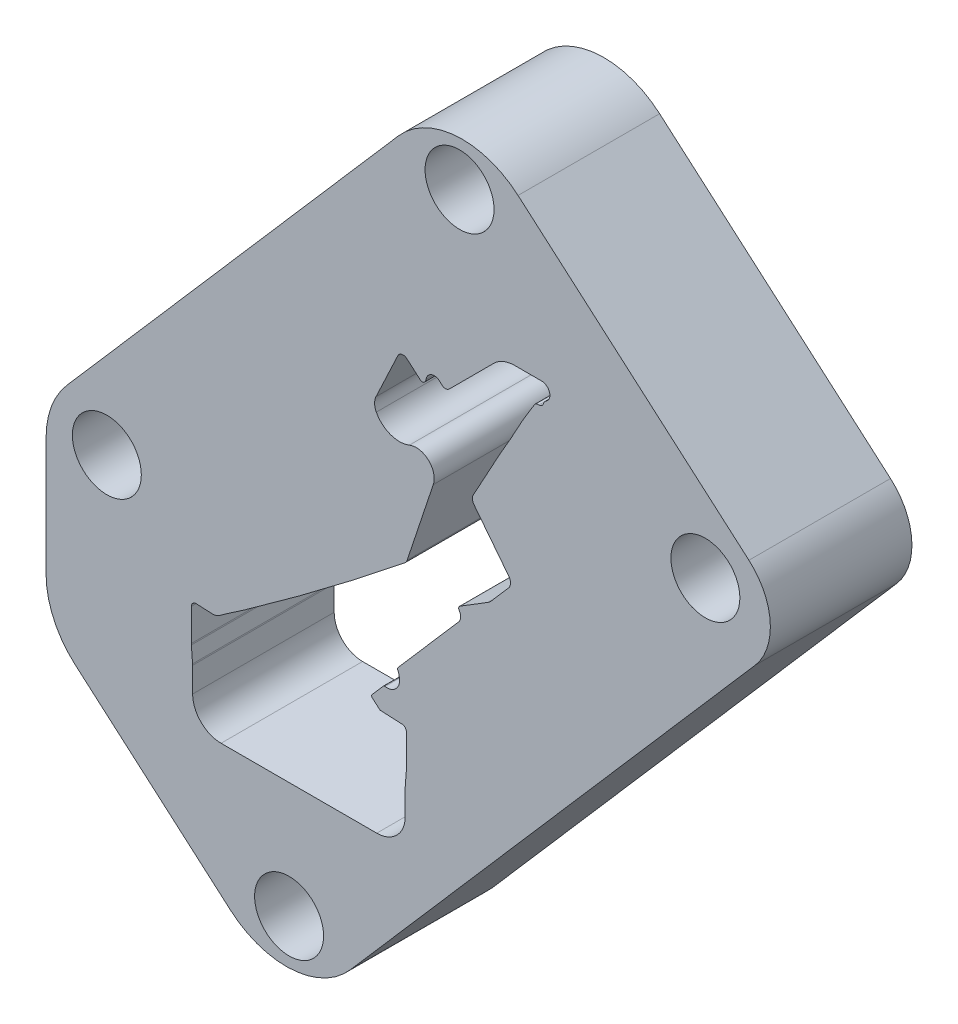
SolidWorks part; units mm, degrees
ref_plane "Front" through (0, 0, 0) normal (0, 0, 1) x (1, 0, 0)
ref_plane "Top" through (0, 0, 0) normal (0, 1, 0) x (1, 0, 0)
ref_plane "Right" through (0, 0, 0) normal (1, 0, 0) x (0, 0, -1)
ref_plane "Plane1"
sketch "Sketch1" plane through (0, 0, 0) normal (0, 0, 1) x (1, 0, 0)
  line L0 (-57.15, -180.975) -> (-450.85, -180.975) construction
  line L1 (-277.3377, -5.7393) -> (-329.1177, 39.2279)
  line L2 (-275.9499, -25.4471) -> (-366.7171, -129.9659)
  line L3 (-393.5913, -131.8583) -> (-428.4159, -101.6157)
  line L4 (-355.9919, 37.3355) -> (-430.3083, -48.2402)
  line L5 (-450.85, 149.225) -> (-450.85, -180.975) construction
  line L10 (-379.857, -85.471) -> (-379.857, 85.471) construction
  line L12 (-300.355, 0) -> (-340.106, 0) construction
  line L13 (-434.975, -87.2323) -> (-434.975, -60.7311)
  arc A0 (-329.1177, 39.2279) -> (-355.9919, 37.3355) centre (-341.6086, 24.8446) ccw
  arc A1 (-366.7171, -129.9659) -> (-393.5913, -131.8583) centre (-381.1005, -117.475) cw
  arc A2 (-428.4159, -101.6157) -> (-434.975, -87.2323) centre (-415.925, -87.2323) cw
  arc A3 (-277.3377, -5.7393) -> (-275.9499, -25.4471) centre (-286.4977, -16.2871) cw
  arc A4 (-430.3083, -48.2402) -> (-434.975, -60.7311) centre (-415.925, -60.7311) ccw
  arc A5 (-360.807, -100.457) -> (-354.457, -94.107) centre (-360.807, -94.107) ccw construction
  point P11 (-343.501, 51.7188)
  point P14 (-299.257, -129.8359)
  point P17 (-438.813, -92.8979)
extrude "Boss-Extrude1" add sketch "Sketch1" against normal blind 31.75 flip side to cut
hole_wizard "Hole1" positions "Point_Sketch" profile "Profil_Sketch" counterbore size "1/4" standard "ANSI Inch"
sketch "Point_Sketch" plane through (-333.7905, -24.1266, 0) normal (0, 0, -1) x (1, 0, 0)
  point P0 (-8.4489, -57.9293)
  point P2 (46.6872, -10.0475)
  point P4 (-46.6791, 102.3065)
  point P6 (-87.5579, 33.1651)
sketch "Profil_Sketch" plane through (-342.2394, 33.8027, 0) normal (1, 0, 0) x (0, -1, 0)
  line L0 (0, 0) -> (0, 31.75)
  line L1 (0, 31.75) -> (5.1562, 31.75)
  line L3 (5.1562, 31.75) -> (5.1562, 17.526)
  line L4 (5.1562, 17.526) -> (7.7343, 17.526)
  line L5 (7.7343, 17.526) -> (7.7343, 0)
  line L7 (7.7343, 0) -> (0, 0)
  line L11 (0, -6.35) -> (0, 107.95) construction
  dimension "Diameter" = 10.3124
  dimension "Thru Hole Depth" = 31.75
  dimension "L1" = 17.526
other "usin_LS160_.375-16x1.75-SHCS<1>"
ref_plane "Plane2 QU250515L_Punch26[Mounted in the strip]-1"
ref_plane "Plane1 QU250515L_Punch26[Mounted in the strip]-1"
sketch "Sketch2 QU250515L_Punch26[Mounted in the strip]-1" plane through (0, 0, 0) normal (0, 0, 1) x (1, 0, 0)
  line L0 (-395.732, -100.457) -> (-360.807, -100.457)
  line L1 (-330.9926, -8.5838) -> (-328.8227, -4.6121)
  line L2 (-333.575, -13.0808) -> (-330.9926, -8.5838)
  line L3 (-339.4259, -23.7902) -> (-333.575, -13.0808)
  line L4 (-331.4508, -35.9487) -> (-339.2462, -25.9811)
  line L5 (-335.3571, -42.3275) -> (-331.5006, -37.8868)
  line L6 (-342.2674, -46.7609) -> (-336.0871, -42.9478)
  line L7 (-356.2916, -65.7245) -> (-342.683, -50.0542)
  line L8 (-356.0262, -67.9839) -> (-356.0832, -67.5125)
  line L9 (-362.0951, -73.879) -> (-359.5997, -71.0056)
  line L10 (-360.19, -76.5426) -> (-362.0194, -74.954)
  line L11 (-355.1831, -76.7786) -> (-360.19, -76.5426)
  line L12 (-354.457, -94.107) -> (-354.457, -77.5397)
  line L13 (-402.082, -77.2405) -> (-402.082, -94.107)
  line L14 (-397.7792, -76.6445) -> (-401.2841, -76.4793)
  line L15 (-390.1929, -72.1537) -> (-394.0689, -74.806)
  line L16 (-347.8332, -26.553) -> (-353.6879, -44.1622)
  line L17 (-355.8003, -5.5368) -> (-360.6884, -15.925)
  line L18 (-351.2631, -7.7925) -> (-354.2397, -5.2075)
  line L19 (-349.7815, -7.636) -> (-349.8298, -7.6916)
  line L20 (-346.4728, -6.3117) -> (-346.832, -5.9525)
  line L21 (-334.357, 3.6489) -> (-344.3176, -6.3117)
  line L22 (-323.8215, 5.5088) -> (-329.8669, 5.5088)
  line L23 (-323.8215, 5.5088) -> (-329.8669, 5.5088)
  line L24 (-334.357, 3.6489) -> (-344.3176, -6.3117)
  line L25 (-346.4728, -6.3117) -> (-346.832, -5.9525)
  line L26 (-349.7815, -7.636) -> (-349.8298, -7.6916)
  line L27 (-351.2631, -7.7925) -> (-354.2397, -5.2075)
  line L28 (-355.8003, -5.5368) -> (-360.6884, -15.925)
  line L29 (-347.8332, -26.553) -> (-353.6879, -44.1622)
  line L30 (-390.1929, -72.1537) -> (-394.0689, -74.806)
  line L31 (-397.7792, -76.6445) -> (-401.2841, -76.4793)
  line L32 (-402.082, -77.2405) -> (-402.082, -94.107)
  line L33 (-354.457, -94.107) -> (-354.457, -77.5397)
  line L34 (-355.1831, -76.7786) -> (-360.19, -76.5426)
  line L35 (-360.19, -76.5426) -> (-362.0194, -74.954)
  line L36 (-362.0951, -73.879) -> (-359.5997, -71.0056)
  line L37 (-356.0262, -67.9839) -> (-356.0832, -67.5125)
  line L38 (-356.2916, -65.7245) -> (-342.683, -50.0542)
  line L39 (-342.2674, -46.7609) -> (-336.0871, -42.9478)
  line L40 (-335.3571, -42.3275) -> (-331.5006, -37.8868)
  line L41 (-331.4508, -35.9487) -> (-339.2462, -25.9811)
  line L42 (-339.4259, -23.7902) -> (-333.575, -13.0808)
  line L43 (-333.575, -13.0808) -> (-330.9926, -8.5838)
  line L44 (-330.9926, -8.5838) -> (-328.8227, -4.6121)
  line L45 (-395.732, -100.457) -> (-360.807, -100.457)
  arc A0 (-360.807, -100.457) -> (-354.457, -94.107) centre (-360.807, -94.107) ccw
  arc A1 (-402.082, -94.107) -> (-395.732, -100.457) centre (-395.732, -94.107) ccw
  arc A2 (-323.0273, 2.6841) -> (-323.6241, 2.0061) centre (-322.2331, 1.3833) ccw
  arc A3 (-323.6241, 2.0061) -> (-323.8295, 1.5414) centre (-274.8211, -19.8428) ccw
  arc A4 (-324.4132, 1.1898) -> (-323.8295, 1.5414) centre (-324.369, 1.7768) ccw
  arc A5 (-324.4132, 1.1898) -> (-325.3006, 0.9984) centre (-324.5334, -0.4056) ccw
  arc A6 (-325.3006, 0.9984) -> (-325.6667, 0.6547) centre (-324.8211, 0.1209) ccw
  arc A7 (-325.6667, 0.6547) -> (-327.9343, -3.0725) centre (-213.8052, -69.9538) ccw
  arc A8 (-327.9343, -3.0725) -> (-328.3877, -3.8375) centre (-295.3841, -22.8808) ccw
  arc A9 (-328.3877, -3.8375) -> (-328.8227, -4.6121) centre (-246.2982, -50.4461) ccw
  arc A10 (-339.4259, -23.7902) -> (-339.2462, -25.9811) centre (-337.6707, -24.7491) ccw
  arc A11 (-331.5006, -37.8868) -> (-331.4508, -35.9487) centre (-332.6513, -36.8875) ccw
  arc A12 (-336.0871, -42.9478) -> (-335.3571, -42.3275) centre (-337.7543, -40.2457) ccw
  arc A13 (-342.2674, -46.7609) -> (-342.5738, -48.1973) centre (-341.734, -47.6256) ccw
  arc A14 (-342.683, -50.0542) -> (-342.5738, -48.1973) centre (-343.8336, -49.0549) ccw
  arc A15 (-356.2916, -65.7245) -> (-356.3817, -66.5953) centre (-355.7162, -66.2241) ccw
  arc A16 (-356.0832, -67.5125) -> (-356.3817, -66.5953) centre (-358.5651, -67.813) ccw
  arc A17 (-358.9038, -70.7528) -> (-356.0262, -67.9839) centre (-358.5081, -68.2843) ccw
  arc A18 (-358.9038, -70.7528) -> (-359.5997, -71.0056) centre (-359.0244, -71.5052) ccw
  arc A19 (-362.0951, -73.879) -> (-362.0194, -74.954) centre (-361.5197, -74.3786) ccw
  arc A20 (-354.457, -77.5397) -> (-355.1831, -76.7786) centre (-355.219, -77.5397) ccw
  arc A21 (-401.2841, -76.4793) -> (-402.082, -77.2405) centre (-401.32, -77.2405) ccw
  arc A22 (-397.7792, -76.6445) -> (-395.8662, -76.0817) centre (-397.6357, -73.5999) ccw
  arc A23 (-394.0689, -74.806) -> (-395.8662, -76.0817) centre (-95.1891, -497.8086) ccw
  arc A24 (-390.1929, -72.1537) -> (-354.3303, -45.0881) centre (-793.7243, 499.8274) ccw
  arc A25 (-354.3303, -45.0881) -> (-353.6879, -44.1622) centre (-355.5857, -43.5312) ccw
  arc A26 (-347.8332, -26.553) -> (-353.6039, -21.1528) centre (-351.961, -25.1806) ccw
  arc A27 (-360.6258, -18.602) -> (-353.6039, -21.1528) centre (-355.7059, -15.999) ccw
  arc A28 (-360.6884, -15.925) -> (-360.6258, -18.602) centre (-357.9773, -17.2007) ccw
  arc A29 (-354.2397, -5.2075) -> (-355.8003, -5.5368) centre (-354.8954, -5.9625) ccw
  arc A30 (-351.2631, -7.7925) -> (-349.8298, -7.6916) centre (-350.5969, -7.0254) ccw
  arc A31 (-349.7815, -7.636) -> (-349.4209, -6.8334) centre (-350.9322, -6.6367) ccw
  arc A32 (-346.832, -5.9525) -> (-349.4209, -6.8334) centre (-347.9097, -7.0301) ccw
  arc A33 (-346.4728, -6.3117) -> (-344.3176, -6.3117) centre (-345.3952, -5.234) ccw
  arc A34 (-329.8669, 5.5088) -> (-334.357, 3.6489) centre (-329.8669, -0.8412) ccw
  arc A35 (-323.0273, 2.6841) -> (-323.8215, 5.5088) centre (-323.8215, 3.9848) ccw
  arc A36 (-323.0273, 2.6841) -> (-323.8215, 5.5088) centre (-323.8215, 3.9848) ccw
  arc A37 (-329.8669, 5.5088) -> (-334.357, 3.6489) centre (-329.8669, -0.8412) ccw
  arc A38 (-346.4728, -6.3117) -> (-344.3176, -6.3117) centre (-345.3952, -5.234) ccw
  arc A39 (-346.832, -5.9525) -> (-349.4209, -6.8334) centre (-347.9097, -7.0301) ccw
  arc A40 (-349.7815, -7.636) -> (-349.4209, -6.8334) centre (-350.9322, -6.6367) ccw
  arc A41 (-351.2631, -7.7925) -> (-349.8298, -7.6916) centre (-350.5969, -7.0254) ccw
  arc A42 (-354.2397, -5.2075) -> (-355.8003, -5.5368) centre (-354.8954, -5.9625) ccw
  arc A43 (-360.6884, -15.925) -> (-360.6258, -18.602) centre (-357.9773, -17.2007) ccw
  arc A44 (-360.6258, -18.602) -> (-353.6039, -21.1528) centre (-355.7059, -15.999) ccw
  arc A45 (-347.8332, -26.553) -> (-353.6039, -21.1528) centre (-351.961, -25.1806) ccw
  arc A46 (-354.3303, -45.0881) -> (-353.6879, -44.1622) centre (-355.5857, -43.5312) ccw
  arc A47 (-390.1929, -72.1537) -> (-354.3303, -45.0881) centre (-793.7243, 499.8274) ccw
  arc A48 (-394.0689, -74.806) -> (-395.8662, -76.0817) centre (-95.1891, -497.8086) ccw
  arc A49 (-397.7792, -76.6445) -> (-395.8662, -76.0817) centre (-397.6357, -73.5999) ccw
  arc A50 (-401.2841, -76.4793) -> (-402.082, -77.2405) centre (-401.32, -77.2405) ccw
  arc A51 (-354.457, -77.5397) -> (-355.1831, -76.7786) centre (-355.219, -77.5397) ccw
  arc A52 (-362.0951, -73.879) -> (-362.0194, -74.954) centre (-361.5197, -74.3786) ccw
  arc A53 (-358.9038, -70.7528) -> (-359.5997, -71.0056) centre (-359.0244, -71.5052) ccw
  arc A54 (-358.9038, -70.7528) -> (-356.0262, -67.9839) centre (-358.5081, -68.2843) ccw
  arc A55 (-356.0832, -67.5125) -> (-356.3817, -66.5953) centre (-358.5651, -67.813) ccw
  arc A56 (-356.2916, -65.7245) -> (-356.3817, -66.5953) centre (-355.7162, -66.2241) ccw
  arc A57 (-342.683, -50.0542) -> (-342.5738, -48.1973) centre (-343.8336, -49.0549) ccw
  arc A58 (-342.2674, -46.7609) -> (-342.5738, -48.1973) centre (-341.734, -47.6256) ccw
  arc A59 (-336.0871, -42.9478) -> (-335.3571, -42.3275) centre (-337.7543, -40.2457) ccw
  arc A60 (-331.5006, -37.8868) -> (-331.4508, -35.9487) centre (-332.6513, -36.8875) ccw
  arc A61 (-339.4259, -23.7902) -> (-339.2462, -25.9811) centre (-337.6707, -24.7491) ccw
  arc A62 (-328.3877, -3.8375) -> (-328.8227, -4.6121) centre (-246.2982, -50.4461) ccw
  arc A63 (-327.9343, -3.0725) -> (-328.3877, -3.8375) centre (-295.3841, -22.8808) ccw
  arc A64 (-325.6667, 0.6547) -> (-327.9343, -3.0725) centre (-213.8052, -69.9538) ccw
  arc A65 (-325.3006, 0.9984) -> (-325.6667, 0.6547) centre (-324.8211, 0.1209) ccw
  arc A66 (-324.4132, 1.1898) -> (-325.3006, 0.9984) centre (-324.5334, -0.4056) ccw
  arc A67 (-324.4132, 1.1898) -> (-323.8295, 1.5414) centre (-324.369, 1.7768) ccw
  arc A68 (-323.6241, 2.0061) -> (-323.8295, 1.5414) centre (-274.8211, -19.8428) ccw
  arc A69 (-323.0273, 2.6841) -> (-323.6241, 2.0061) centre (-322.2331, 1.3833) ccw
  arc A70 (-402.082, -94.107) -> (-395.732, -100.457) centre (-395.732, -94.107) ccw
  arc A71 (-360.807, -100.457) -> (-354.457, -94.107) centre (-360.807, -94.107) ccw
  circle A72 centre (-340.106, -10.795) radius 1.2065
  circle A73 centre (-340.106, -36.195) radius 1.2065
  circle A74 centre (-367.157, -65.0875) radius 5.3594
  circle A75 centre (-392.557, -90.932) radius 5.3594
  circle A76 centre (-363.982, -90.932) radius 5.3594
  circle A110 centre (-340.106, -36.195) radius 1.2065
  circle A111 centre (-340.106, -10.795) radius 1.2065
  circle A117 centre (-363.982, -90.932) radius 5.3594
  circle A118 centre (-392.557, -90.932) radius 5.3594
  circle A119 centre (-367.157, -65.0875) radius 5.3594
sketch "Sketch1 QU250515L_Punch26[Mounted in the strip]-1" plane through (0, 0, -4.7625) normal (0, 0, 1) x (1, 0, 0)
  line L0 (-355.1831, -76.7786) -> (-360.19, -76.5426) construction
  line L1 (-360.19, -76.5426) -> (-362.0194, -74.954) construction
  line L2 (-362.0951, -73.879) -> (-359.5997, -71.0056) construction
  line L3 (-356.0262, -67.9839) -> (-356.0832, -67.5125) construction
  line L4 (-356.2916, -65.7245) -> (-342.683, -50.0542) construction
  line L5 (-342.2674, -46.7609) -> (-336.0871, -42.9478) construction
  line L6 (-335.3571, -42.3275) -> (-331.5006, -37.8868) construction
  line L7 (-331.4508, -35.9487) -> (-339.2462, -25.9811) construction
  line L8 (-339.4259, -23.7902) -> (-333.575, -13.0808) construction
  line L9 (-333.575, -13.0808) -> (-330.9926, -8.5838) construction
  line L10 (-330.9926, -8.5838) -> (-328.8227, -4.6121) construction
  line L11 (-323.8215, 5.5088) -> (-329.8669, 5.5088) construction
  line L12 (-334.357, 3.6489) -> (-344.3176, -6.3117) construction
  line L13 (-346.4728, -6.3117) -> (-346.832, -5.9525) construction
  line L14 (-349.7815, -7.636) -> (-349.8298, -7.6916) construction
  line L15 (-351.2631, -7.7925) -> (-354.2397, -5.2075) construction
  line L16 (-355.8003, -5.5368) -> (-360.6884, -15.925) construction
  line L17 (-347.8332, -26.553) -> (-353.6879, -44.1622) construction
  line L18 (-390.1929, -72.1537) -> (-394.0689, -74.806) construction
  line L19 (-397.7792, -76.6445) -> (-401.2841, -76.4793) construction
  line L20 (-355.1831, -76.7786) -> (-360.19, -76.5426) construction
  line L21 (-360.19, -76.5426) -> (-362.0194, -74.954) construction
  line L22 (-362.0951, -73.879) -> (-359.5997, -71.0056) construction
  line L69 (-356.0262, -67.9839) -> (-356.0832, -67.5125) construction
  line L70 (-356.2916, -65.7245) -> (-342.683, -50.0542) construction
  line L71 (-342.2674, -46.7609) -> (-336.0871, -42.9478) construction
  line L72 (-335.3571, -42.3275) -> (-331.5006, -37.8868) construction
  line L73 (-331.4508, -35.9487) -> (-339.2462, -25.9811) construction
  line L74 (-339.4259, -23.7902) -> (-333.575, -13.0808) construction
  line L75 (-333.575, -13.0808) -> (-330.9926, -8.5838) construction
  line L76 (-330.9926, -8.5838) -> (-328.8227, -4.6121) construction
  line L77 (-323.8215, 5.5088) -> (-329.8669, 5.5088) construction
  line L78 (-334.357, 3.6489) -> (-344.3176, -6.3117) construction
  line L79 (-346.4728, -6.3117) -> (-346.832, -5.9525) construction
  line L80 (-349.7815, -7.636) -> (-349.8298, -7.6916) construction
  line L81 (-351.2631, -7.7925) -> (-354.2397, -5.2075) construction
  line L82 (-355.8003, -5.5368) -> (-360.6884, -15.925) construction
  line L83 (-347.8332, -26.553) -> (-353.6879, -44.1622) construction
  line L84 (-390.1929, -72.1537) -> (-394.0689, -74.806) construction
  line L85 (-397.7792, -76.6445) -> (-401.2841, -76.4793) construction
  line L86 (-402.082, -88.2004) -> (-402.082, -77.2405) construction
  line L87 (-402.082, -77.2405) -> (-402.082, -94.107) construction
  line L88 (-354.457, -77.5397) -> (-354.457, -88.3556) construction
  line L89 (-354.457, -94.107) -> (-354.457, -77.5397) construction
  line L90 (-354.4316, -88.3661) -> (-354.4316, -94.107) construction
  line L91 (-355.1681, -76.4589) -> (-360.064, -76.2281)
  line L92 (-360.064, -76.2281) -> (-361.8095, -74.7123)
  line L93 (-361.8534, -74.0888) -> (-359.3581, -71.2154)
  line L94 (-355.7085, -67.9454) -> (-355.7655, -67.474)
  line L95 (-356.0499, -65.9344) -> (-342.4413, -50.264)
  line L96 (-342.0994, -47.0333) -> (-335.9191, -43.2202)
  line L97 (-335.1154, -42.5374) -> (-331.259, -38.0967)
  line L98 (-331.1987, -35.7515) -> (-338.9941, -25.784)
  line L99 (-339.145, -23.9436) -> (-333.2957, -13.2372)
  line L100 (-333.2957, -13.2372) -> (-330.7134, -8.7403)
  line L101 (-330.7134, -8.7403) -> (-328.5424, -4.7665)
  line L102 (-323.8215, 5.8288) -> (-329.8669, 5.8288)
  line L103 (-334.5833, 3.8752) -> (-344.5439, -6.0854)
  line L104 (-346.2465, -6.0854) -> (-346.6057, -5.7262)
  line L105 (-350.0231, -7.4262) -> (-350.0714, -7.4818)
  line L106 (-351.0532, -7.5509) -> (-354.0299, -4.9659)
  line L107 (-356.0898, -5.4005) -> (-360.978, -15.7888)
  line L108 (-348.1369, -26.4521) -> (-353.9916, -44.0612)
  line L109 (-390.3755, -71.8908) -> (-394.2516, -74.5432)
  line L110 (-397.7641, -76.3248) -> (-401.2691, -76.1596)
  line L111 (-402.1074, -94.107) -> (-402.1074, -88.5208) construction
  line L112 (-354.457, -88.3661) -> (-354.457, -94.107) construction
  line L113 (-402.082, -94.107) -> (-402.082, -88.5208) construction
  line L114 (-395.732, -100.457) -> (-360.807, -100.457) construction
  line L115 (-395.732, -100.457) -> (-360.807, -100.457) construction
  line L116 (-354.4316, -88.5342) -> (-354.4316, -94.107)
  line L117 (-395.732, -100.4824) -> (-360.807, -100.4824)
  line L118 (-402.1074, -94.107) -> (-402.1074, -88.5342)
  line L119 (-354.137, -77.5397) -> (-354.137, -88.3556) construction
  line L120 (-402.402, -88.2004) -> (-402.402, -77.2405) construction
  line L121 (-354.137, -77.5397) -> (-354.137, -84.4398)
  line L122 (-402.402, -84.4398) -> (-402.402, -77.2405)
  line L123 (-354.1479, -84.7238) -> (-354.4206, -88.2502)
  line L124 (-402.1184, -88.2502) -> (-402.3911, -84.7238)
  arc A0 (-354.457, -77.5397) -> (-355.1831, -76.7786) centre (-355.219, -77.5397) ccw construction
  arc A1 (-362.0951, -73.879) -> (-362.0194, -74.954) centre (-361.5197, -74.3786) ccw construction
  arc A2 (-358.9038, -70.7528) -> (-359.5997, -71.0056) centre (-359.0244, -71.5052) ccw construction
  arc A3 (-358.9038, -70.7528) -> (-356.0262, -67.9839) centre (-358.5081, -68.2843) ccw construction
  arc A4 (-356.0832, -67.5125) -> (-356.3817, -66.5953) centre (-358.5651, -67.813) ccw construction
  arc A5 (-356.2916, -65.7245) -> (-356.3817, -66.5953) centre (-355.7162, -66.2241) ccw construction
  arc A6 (-342.683, -50.0542) -> (-342.5738, -48.1973) centre (-343.8336, -49.0549) ccw construction
  arc A7 (-342.2674, -46.7609) -> (-342.5738, -48.1973) centre (-341.734, -47.6256) ccw construction
  arc A8 (-336.0871, -42.9478) -> (-335.3571, -42.3275) centre (-337.7543, -40.2457) ccw construction
  arc A9 (-331.5006, -37.8868) -> (-331.4508, -35.9487) centre (-332.6513, -36.8875) ccw construction
  arc A10 (-339.4259, -23.7902) -> (-339.2462, -25.9811) centre (-337.6707, -24.7491) ccw construction
  arc A11 (-328.3877, -3.8375) -> (-328.8227, -4.6121) centre (-246.2982, -50.4461) ccw construction
  arc A12 (-327.9343, -3.0725) -> (-328.3877, -3.8375) centre (-295.3841, -22.8808) ccw construction
  arc A13 (-325.6667, 0.6547) -> (-327.9343, -3.0725) centre (-213.8052, -69.9538) ccw construction
  arc A14 (-325.3006, 0.9984) -> (-325.6667, 0.6547) centre (-324.8211, 0.1209) ccw construction
  arc A15 (-324.4132, 1.1898) -> (-325.3006, 0.9984) centre (-324.5334, -0.4056) ccw construction
  arc A16 (-324.4132, 1.1898) -> (-323.8295, 1.5414) centre (-324.369, 1.7768) ccw construction
  arc A17 (-323.6241, 2.0061) -> (-323.8295, 1.5414) centre (-274.8211, -19.8428) ccw construction
  arc A18 (-323.0273, 2.6841) -> (-323.6241, 2.0061) centre (-322.2331, 1.3833) ccw construction
  arc A19 (-323.0273, 2.6841) -> (-323.8215, 5.5088) centre (-323.8215, 3.9848) ccw construction
  arc A20 (-329.8669, 5.5088) -> (-334.357, 3.6489) centre (-329.8669, -0.8412) ccw construction
  arc A21 (-346.4728, -6.3117) -> (-344.3176, -6.3117) centre (-345.3952, -5.234) ccw construction
  arc A22 (-346.832, -5.9525) -> (-349.4209, -6.8334) centre (-347.9097, -7.0301) ccw construction
  arc A23 (-349.7815, -7.636) -> (-349.4209, -6.8334) centre (-350.9322, -6.6367) ccw construction
  arc A24 (-351.2631, -7.7925) -> (-349.8298, -7.6916) centre (-350.5969, -7.0254) ccw construction
  arc A25 (-354.2397, -5.2075) -> (-355.8003, -5.5368) centre (-354.8954, -5.9625) ccw construction
  arc A26 (-360.6884, -15.925) -> (-360.6258, -18.602) centre (-357.9773, -17.2007) ccw construction
  arc A27 (-360.6258, -18.602) -> (-353.6039, -21.1528) centre (-355.7059, -15.999) ccw construction
  arc A28 (-347.8332, -26.553) -> (-353.6039, -21.1528) centre (-351.961, -25.1806) ccw construction
  arc A29 (-354.3303, -45.0881) -> (-353.6879, -44.1622) centre (-355.5857, -43.5312) ccw construction
  arc A30 (-390.1929, -72.1537) -> (-354.3303, -45.0881) centre (-793.7243, 499.8274) ccw construction
  arc A31 (-394.0689, -74.806) -> (-395.8662, -76.0817) centre (-95.1891, -497.8086) ccw construction
  arc A32 (-397.7792, -76.6445) -> (-395.8662, -76.0817) centre (-397.6357, -73.5999) ccw construction
  arc A33 (-401.2841, -76.4793) -> (-402.082, -77.2405) centre (-401.32, -77.2405) ccw construction
  arc A34 (-354.457, -77.5397) -> (-355.1831, -76.7786) centre (-355.219, -77.5397) ccw construction
  arc A35 (-362.0951, -73.879) -> (-362.0194, -74.954) centre (-361.5197, -74.3786) ccw construction
  arc A37 (-358.9038, -70.7528) -> (-359.5997, -71.0056) centre (-359.0244, -71.5052) ccw construction
  arc A38 (-358.9038, -70.7528) -> (-356.0262, -67.9839) centre (-358.5081, -68.2843) ccw construction
  arc A39 (-356.0832, -67.5125) -> (-356.3817, -66.5953) centre (-358.5651, -67.813) ccw construction
  arc A41 (-356.2916, -65.7245) -> (-356.3817, -66.5953) centre (-355.7162, -66.2241) ccw construction
  arc A43 (-342.683, -50.0542) -> (-342.5738, -48.1973) centre (-343.8336, -49.0549) ccw construction
  arc A45 (-342.2674, -46.7609) -> (-342.5738, -48.1973) centre (-341.734, -47.6256) ccw construction
  arc A46 (-336.0871, -42.9478) -> (-335.3571, -42.3275) centre (-337.7543, -40.2457) ccw construction
  arc A47 (-331.5006, -37.8868) -> (-331.4508, -35.9487) centre (-332.6513, -36.8875) ccw construction
  arc A48 (-339.4259, -23.7902) -> (-339.2462, -25.9811) centre (-337.6707, -24.7491) ccw construction
  arc A57 (-328.3877, -3.8375) -> (-328.8227, -4.6121) centre (-246.2982, -50.4461) ccw construction
  arc A58 (-327.9343, -3.0725) -> (-328.3877, -3.8375) centre (-295.3841, -22.8808) ccw construction
  arc A59 (-325.6667, 0.6547) -> (-327.9343, -3.0725) centre (-213.8052, -69.9538) ccw construction
  arc A61 (-325.3006, 0.9984) -> (-325.6667, 0.6547) centre (-324.8211, 0.1209) ccw construction
  arc A62 (-324.4132, 1.1898) -> (-325.3006, 0.9984) centre (-324.5334, -0.4056) ccw construction
  arc A63 (-324.4132, 1.1898) -> (-323.8295, 1.5414) centre (-324.369, 1.7768) ccw construction
  arc A66 (-323.6241, 2.0061) -> (-323.8295, 1.5414) centre (-274.8211, -19.8428) ccw construction
  arc A68 (-323.0273, 2.6841) -> (-323.6241, 2.0061) centre (-322.2331, 1.3833) ccw construction
  arc A70 (-323.0273, 2.6841) -> (-323.8215, 5.5088) centre (-323.8215, 3.9848) ccw construction
  arc A71 (-329.8669, 5.5088) -> (-334.357, 3.6489) centre (-329.8669, -0.8412) ccw construction
  arc A108 (-346.4728, -6.3117) -> (-344.3176, -6.3117) centre (-345.3952, -5.234) ccw construction
  arc A109 (-346.832, -5.9525) -> (-349.4209, -6.8334) centre (-347.9097, -7.0301) ccw construction
  arc A110 (-349.7815, -7.636) -> (-349.4209, -6.8334) centre (-350.9322, -6.6367) ccw construction
  arc A111 (-351.2631, -7.7925) -> (-349.8298, -7.6916) centre (-350.5969, -7.0254) ccw construction
  arc A112 (-354.2397, -5.2075) -> (-355.8003, -5.5368) centre (-354.8954, -5.9625) ccw construction
  arc A113 (-360.6884, -15.925) -> (-360.6258, -18.602) centre (-357.9773, -17.2007) ccw construction
  arc A114 (-360.6258, -18.602) -> (-353.6039, -21.1528) centre (-355.7059, -15.999) ccw construction
  arc A115 (-347.8332, -26.553) -> (-353.6039, -21.1528) centre (-351.961, -25.1806) ccw construction
  arc A116 (-354.3303, -45.0881) -> (-353.6879, -44.1622) centre (-355.5857, -43.5312) ccw construction
  arc A117 (-390.1929, -72.1537) -> (-354.3303, -45.0881) centre (-793.7243, 499.8274) ccw construction
  arc A118 (-394.0689, -74.806) -> (-395.8662, -76.0817) centre (-95.1891, -497.8086) ccw construction
  arc A119 (-397.7792, -76.6445) -> (-395.8662, -76.0817) centre (-397.6357, -73.5999) ccw construction
  arc A120 (-401.2841, -76.4793) -> (-402.082, -77.2405) centre (-401.32, -77.2405) ccw construction
  arc A121 (-354.137, -77.5397) -> (-355.1681, -76.4589) centre (-355.219, -77.5397) ccw
  arc A122 (-361.8534, -74.0888) -> (-361.8095, -74.7123) centre (-361.5197, -74.3786) ccw
  arc A123 (-358.9544, -71.0688) -> (-359.3581, -71.2154) centre (-359.0244, -71.5052) ccw
  arc A124 (-358.9544, -71.0688) -> (-355.7085, -67.9454) centre (-358.5081, -68.2843) ccw
  arc A125 (-355.7655, -67.474) -> (-356.1022, -66.4394) centre (-358.5651, -67.813) ccw
  arc A126 (-356.0499, -65.9344) -> (-356.1022, -66.4394) centre (-355.7162, -66.2241) ccw
  arc A127 (-342.4413, -50.264) -> (-342.3093, -48.0172) centre (-343.8336, -49.0549) ccw
  arc A128 (-342.0994, -47.0333) -> (-342.3093, -48.0172) centre (-341.734, -47.6256) ccw
  arc A129 (-335.9191, -43.2202) -> (-335.1154, -42.5374) centre (-337.7543, -40.2457) ccw
  arc A130 (-331.259, -38.0967) -> (-331.1987, -35.7515) centre (-332.6513, -36.8875) ccw
  arc A131 (-339.145, -23.9436) -> (-338.9941, -25.784) centre (-337.6707, -24.7491) ccw
  arc A132 (-328.1099, -3.9965) -> (-328.5424, -4.7665) centre (-246.2982, -50.4461) ccw
  arc A133 (-327.6595, -3.2366) -> (-328.1099, -3.9965) centre (-295.3841, -22.8808) ccw
  arc A134 (-325.3961, 0.4838) -> (-327.6595, -3.2366) centre (-213.8052, -69.9538) ccw
  arc A135 (-325.1471, 0.7176) -> (-325.3961, 0.4838) centre (-324.8211, 0.1209) ccw
  arc A136 (-324.4373, 0.8707) -> (-325.1471, 0.7176) centre (-324.5334, -0.4056) ccw
  arc A137 (-324.4373, 0.8707) -> (-323.5361, 1.4134) centre (-324.369, 1.7768) ccw
  arc A138 (-323.332, 1.8753) -> (-323.5361, 1.4134) centre (-274.8211, -19.8428) ccw
  arc A139 (-322.8605, 2.4109) -> (-323.332, 1.8753) centre (-322.2331, 1.3833) ccw
  arc A140 (-322.8605, 2.4109) -> (-323.8215, 5.8288) centre (-323.8215, 3.9848) ccw
  arc A141 (-329.8669, 5.8288) -> (-334.5833, 3.8752) centre (-329.8669, -0.8412) ccw
  arc A142 (-346.2465, -6.0854) -> (-344.5439, -6.0854) centre (-345.3952, -5.234) ccw
  arc A143 (-346.6057, -5.7262) -> (-349.7383, -6.7921) centre (-347.9097, -7.0301) ccw
  arc A144 (-350.0231, -7.4262) -> (-349.7383, -6.7921) centre (-350.9322, -6.6367) ccw
  arc A145 (-351.0532, -7.5509) -> (-350.0714, -7.4818) centre (-350.5969, -7.0254) ccw
  arc A146 (-354.0299, -4.9659) -> (-356.0898, -5.4005) centre (-354.8954, -5.9625) ccw
  arc A147 (-360.978, -15.7888) -> (-360.9087, -18.7516) centre (-357.9773, -17.2007) ccw
  arc A148 (-360.9087, -18.7516) -> (-353.483, -21.4491) centre (-355.7059, -15.999) ccw
  arc A149 (-348.1369, -26.4521) -> (-353.483, -21.4491) centre (-351.961, -25.1806) ccw
  arc A150 (-354.5312, -44.8389) -> (-353.9916, -44.0612) centre (-355.5857, -43.5312) ccw
  arc A151 (-390.3755, -71.8908) -> (-354.5312, -44.8389) centre (-793.7243, 499.8274) ccw
  arc A152 (-394.2516, -74.5432) -> (-396.052, -75.8211) centre (-95.1891, -497.8086) ccw
  arc A153 (-397.7641, -76.3248) -> (-396.052, -75.8211) centre (-397.6357, -73.5999) ccw
  arc A154 (-401.2691, -76.1596) -> (-402.402, -77.2405) centre (-401.32, -77.2405) ccw
  arc A155 (-402.082, -94.107) -> (-395.732, -100.457) centre (-395.732, -94.107) ccw construction
  arc A156 (-360.807, -100.457) -> (-354.457, -94.107) centre (-360.807, -94.107) ccw construction
  arc A157 (-402.082, -94.107) -> (-395.732, -100.457) centre (-395.732, -94.107) ccw construction
  arc A158 (-360.807, -100.457) -> (-354.457, -94.107) centre (-360.807, -94.107) ccw construction
  arc A159 (-360.807, -100.4824) -> (-354.4316, -94.107) centre (-360.807, -94.107) ccw
  arc A160 (-402.1074, -94.107) -> (-395.732, -100.4824) centre (-395.732, -94.107) ccw
  arc A161 (-354.137, -84.4398) -> (-354.1479, -84.7238) centre (-357.82, -84.4398) cw
  arc A162 (-354.4316, -88.5342) -> (-354.4206, -88.2502) centre (-350.7486, -88.5342) cw
  arc A163 (-402.1074, -88.5342) -> (-402.1184, -88.2502) centre (-405.7904, -88.5342) ccw
  arc A164 (-402.402, -84.4398) -> (-402.3911, -84.7238) centre (-398.719, -84.4398) ccw
  point P206 (-354.137, -84.582)
  point P210 (-354.4316, -88.392)
extrude "Cut-Extrude1 QU250515L_Punch26[Mounted in the strip]-1" cut sketch "Sketch1 QU250515L_Punch26[Mounted in the strip]-1" against normal through all and the other way through all
